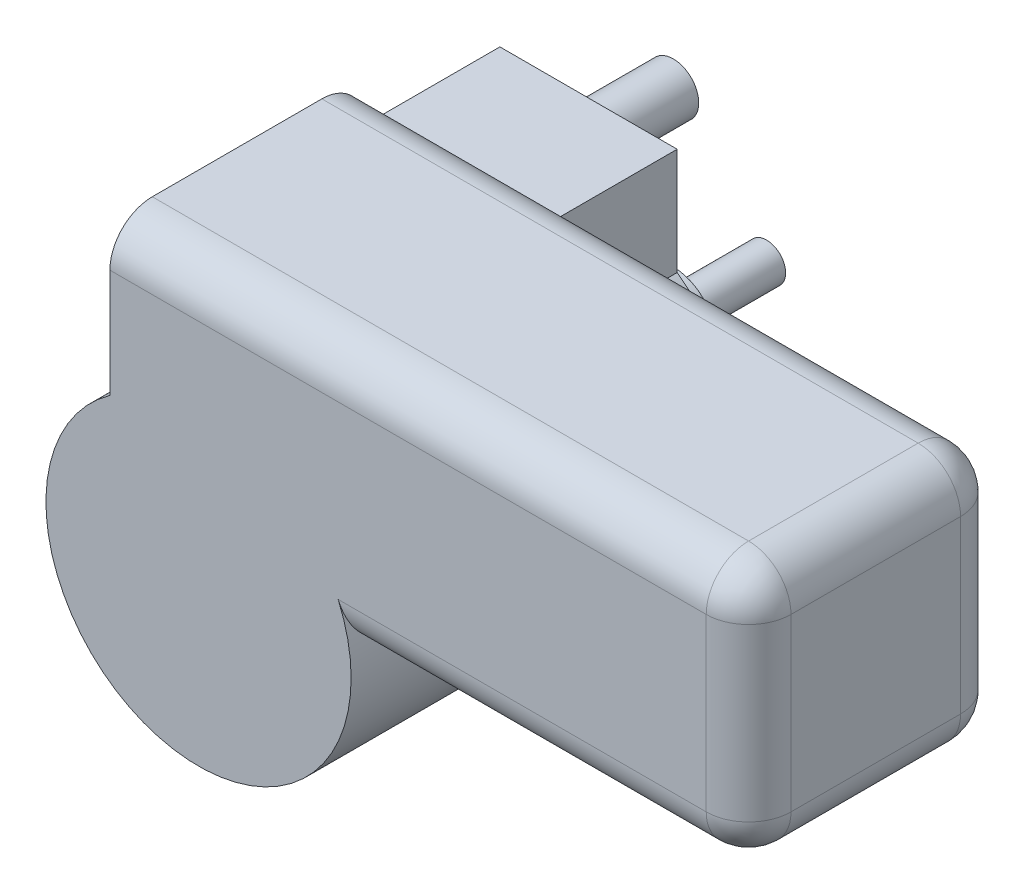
SolidWorks part; units mm, degrees
ref_plane "Front Plane" through (0, 0, 0) normal (0, 0, 1) x (1, 0, 0)
ref_plane "Top Plane" through (0, 0, 0) normal (0, 1, 0) x (1, 0, 0)
ref_plane "Right Plane" through (0, 0, 0) normal (1, 0, 0) x (0, 0, -1)
sketch "Sketch1" plane through (0, 0, 0) normal (0, 0, 1) x (1, 0, 0)
  circle A0 centre (0, 0) radius 36
  dimension "D1" = 72
extrude "Boss-Extrude1" add sketch "Sketch1" along normal blind 92
sketch "Sketch2" plane through (0, 0, 92) normal (0, 0, 1) x (1, 0, 0)
  line L2 (-20.9106, 29.3044) -> (-20.9106, 64.8814)
  line L3 (-20.9106, 64.8814) -> (129.7628, 64.8814)
  line L4 (129.7628, 29.3044) -> (129.7628, 64.8814)
  line L6 (129.7628, 29.3044) -> (129.7628, 4.5402)
  line L7 (129.7628, 4.5402) -> (35.7126, 4.5402)
  circle A0 centre (0, 0) radius 36 construction
  circle A2 centre (0, 0) radius 36
extrude "Boss-Extrude2" add sketch "Sketch2" against normal blind 60 separate body contours L7 L6 L4 L3 L2 M1
sketch "Sketch4" plane through (0, 0, 0) normal (0, 0, -1) x (-1, 0, 0)
  line L0 (-33.5, -19.5) -> (33.5, -19.5) construction
  circle A0 centre (0, 0) radius 10
  circle A1 centre (33.5, -19.5) radius 6
  circle A2 centre (-33.5, -19.5) radius 6
  circle A3 centre (0, 46.5) radius 6
  point P9 (0, -19.5)
  dimension "D3" = 20
  dimension "D4" = 12
  dimension "D1" = 67
  dimension "D2" = 19.5
  dimension "D5" = 46.5
sketch "Sketch5" plane through (0, 0, 0) normal (0, 0, -1) x (-1, 0, 0)
  line L0 (20.9106, 29.3044) -> (20.9106, 64.8814) construction
  line L1 (-20.911, 29.3041) -> (20.9106, 29.3041)
  line L2 (-20.911, 29.3041) -> (-20.911, 54.5)
  line L3 (-20.911, 54.5) -> (20.9106, 54.5)
  line L4 (20.9106, 29.3041) -> (20.9106, 54.5)
  arc A0 (20.9106, 29.3044) -> (-35.7126, 4.5402) centre (0, 0) ccw construction
  dimension "D1" = 20.911
  dimension "D2" = 8
extrude "Boss-Extrude3" add sketch "Sketch5" against normal up to surface (32 mm away)
extrude "Boss-Extrude4" add sketch "Sketch4" along normal blind 20
sketch "Sketch6" plane through (0, 0, -20) normal (0, 0, -1) x (-1, 0, 0)
  circle A0 centre (0, 0) radius 4.5
  dimension "D1" = 9
extrude "Boss-Extrude5" add sketch "Sketch6" along normal blind 22
hole_wizard "M6x0.75 Tapped Hole1" positions "Sketch7" profile "Sketch8" tap size "M6x0.75" standard "DIN"
sketch "Sketch7" plane through (0, 0, -20) normal (0, 0, -1) x (-1, 0, 0)
  point P0 (-33.5, -19.5)
  point P3 (33.5, -19.5)
  point P6 (0, 46.5)
sketch "Sketch8" plane through (33.5, -19.5, -20) normal (1, 0, 0) x (0, 1, 0)
  line L0 (0, 0) -> (0, 15.8273)
  line L1 (0, 15.8273) -> (2.625, 14.25)
  line L2 (2.625, 14.25) -> (2.625, 0.4)
  line L3 (2.625, 0.4) -> (3.025, 0)
  line L5 (3.025, 0) -> (0, 0)
  line L6 (-2.625, 0.4) -> (-3.025, 0) construction
  line L10 (0, 15.8273) -> (-2.625, 14.25) construction
  line L11 (0, -6.35) -> (0, 107.95) construction
  dimension "Tap Drill Dia." = 5.25
  dimension "Tap Drill Depth" = 14.25
  dimension "Near C'Sink Dia." = 6.05
  dimension "Near C'Sink Angle" = 90
  dimension "Drill Angle" = 118
fillet "Fillet2" radius 10 2 edges at (54.4261, 64.8814, 32) (54.4261, 64.8814, 92)
fillet "Fillet3" radius 10 8 edges at (129.7628, 29.7108, 92) (129.7628, 61.9525, 89.0711) (129.7628, 64.8814, 62) (129.7628, 61.9525, 34.9289) (129.7628, 29.7108, 32) (129.7628, 4.5402, 62) (82.7377, 4.5402, 32) (82.7377, 4.5402, 92)
